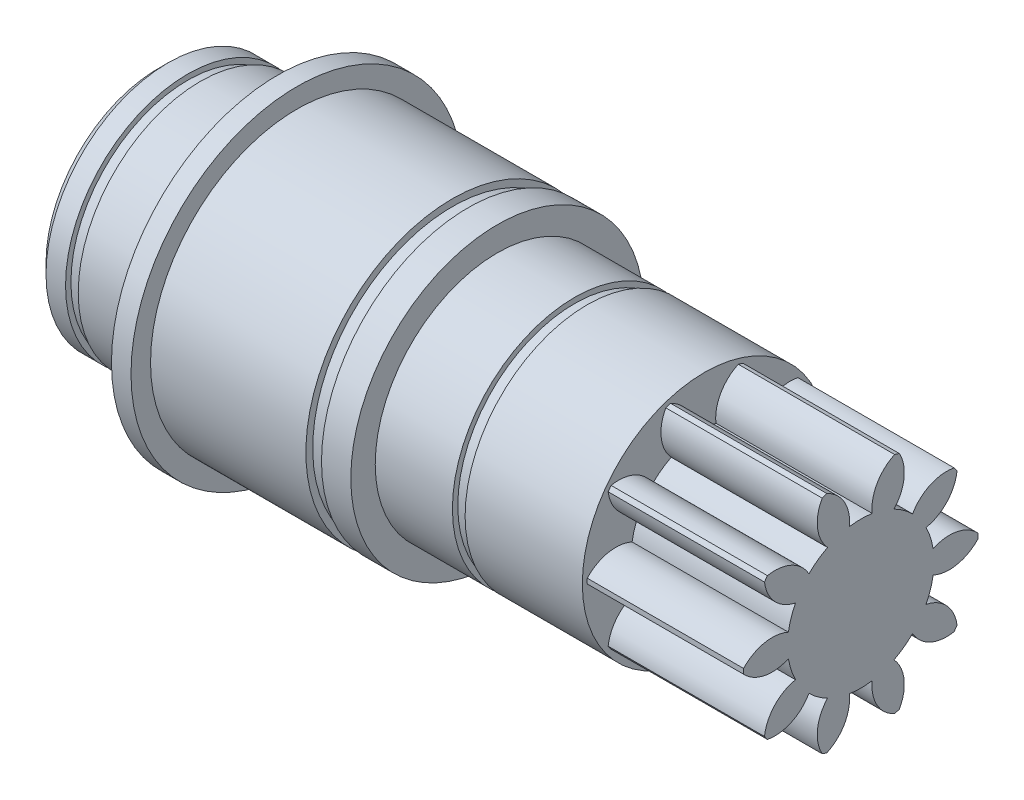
SolidWorks part; units mm, degrees
ref_plane "Plane1" through (0, 0, 0) normal (0, 0, 1) x (1, 0, 0)
ref_plane "Plane2" through (0, 0, 0) normal (0, 1, 0) x (1, 0, 0)
ref_plane "Plane3" through (0, 0, 0) normal (1, 0, 0) x (0, 0, -1)
sketch "HoldingSke" plane through (0, 0, 0) normal (0, 1, 0) x (1, 0, 0)
  line L0 (0, 0) -> (0.4924, -0.0868)
  line L1 (-15, 0) -> (100, 0) construction
  line L2 (0, 0) -> (-2.1039, 2.3779)
  line L3 (0, 0) -> (-11.863, 4.5341)
  line L4 (0, 0) -> (8.5048, 1.4996)
  line L5 (0, 0) -> (-46.8476, -17.4728)
  line L6 (0, 0) -> (-13.2634, -8.9489)
  line L7 (-2.1039, 2.3779) -> (8.6586, 51.2059)
  line L8 (-76.2, 54.61) -> (-73.9, 54.61)
  line L9 (-71.009, 38.7566) -> (-53.1078, 45.2721)
  line L10 (-76.2, 71.12) -> (104.1128, 71.12)
  line L11 (0, 0) -> (-16, 0)
  line L12 (-76.2, 101.6) -> (-76.133, 101.6)
  line L13 (24.9733, 27.94) -> (52.9518, 28.4284)
  line L14 (24.9733, 27.94) -> (24.9743, 27.94)
  line L15 (24.9733, 27.94) -> (100.4006, 29.5858)
  line L16 (-63.627, -2) -> (-12.827, -2)
  circle A0 centre (0, 0) radius 8
  circle A1 centre (0, 0) radius 7.499
  circle A2 centre (0, 0) radius 37.5
  circle A3 centre (0, 0) radius 7.4736
  dimension "MHD" = 14.998
  dimension "Hub_dia" = 75
  dimension "Bore" = 16
  dimension "MBD" = 14.9472
  dimension "Num_teeth" = 10
  dimension "Pitch_radius" = 180.3128
  dimension "Pitch" = 0.5
  dimension "Width" = 16
  dimension "Overall_len" = 50
  dimension "Show_teeth" = 10
  dimension "Thickness" = 16
  dimension "OAL" = 50.0001
  dimension "T_dim" = 2.3
  dimension "Ap" = 20
  dimension "H" = 19.05
  dimension "Backlash" = 0.067
  dimension "Addendum_fac" = 1
  dimension "Dedendum_fac" = 1.25
  dimension "Clearance_fac" = 0.25
  dimension "Dedendum_add" = 0.001
  dimension "Module" = 2
sketch "BasProSke" plane through (0, 0, 0) normal (0, 1, 0) x (1, 0, 0)
  line L0 (-10, 0) -> (60, 0) construction
  line L1 (0, 0) -> (0, 12)
  line L2 (0, 0) -> (16, 0)
  line L3 (16, 0) -> (16, 12)
  line L4 (16, 12) -> (0, 12)
  dimension "Diameter" = 24
  dimension "Thickness" = 16
revolve "Base-Revolve" add sketch "BasProSke" angle 360 about L0
sketch "TooCutSke" plane through (0, 0, 0) normal (1, 0, 0) x (0, 0, -1)
  line L1 (0, 0) -> (0, 107) construction
  line L2 (0, 0) -> (-1.6814, 9.8576) construction
  line L3 (0, 0) -> (-6.1153, 18.8209) construction
  line L4 (-1.6814, 9.8576) -> (-3.0576, 9.4105) construction
  arc A0 (1.1737, 7.4066) -> (-1.1737, 7.4066) centre (0, 0) ccw
  arc A1 (3.4979, 11.5054) -> (-3.4979, 11.5054) centre (0, 0) ccw
  circle A2 centre (0, 0) radius 10 construction
  circle A3 centre (0, 0) radius 9.3969 construction
  arc A4 (-1.1737, 7.4066) -> (-3.4979, 11.5054) centre (-5.1477, 7.8615) ccw
  arc A5 (3.4979, 11.5054) -> (1.1737, 7.4066) centre (5.1477, 7.8615) ccw
  dimension "Root_dia" = 14.998
  dimension "Overcut_dia" = 24.0508
  dimension "Pitch_dia" = 20
  dimension "Base_dia" = 18.7939
  dimension "Flank_rad" = 4
  dimension "Half_ang" = 18
  dimension "Half_CT" = 1.4471
extrude "ToothCut" cut sketch "TooCutSke" along normal through all
fillet "Breaks" radius 0.04
fillet "RootFillets" radius 0.501
pattern_circular "TeethCuts" count 10 every 36 about axis through (-10, 0, 0) along (1, 0, 0) of "ToothCut", "RootFillets", "Breaks"
sketch "HubNeaOneSke" plane through (0, 0, 0) normal (-1, 0, 0) x (0, 0, 1)
  circle A0 centre (0, 0) radius 7.499
  dimension "Diameter" = 14.998
extrude "HubNearOne" add sketch "HubNeaOneSke" along normal blind 34.0001
sketch "HubNeaBotSke" plane through (0, 0, 0) normal (-1, 0, 0) x (0, 0, 1)
  circle A0 centre (0, 0) radius 7.499
  dimension "Diameter" = 14.998
extrude "HubNearBoth" add sketch "HubNeaBotSke" along normal blind 17
ref_plane "FarPln" through (16, 0, 0) normal (1, 0, 0) x (0, 0, -1)
sketch "HubFarSke" plane through (16, 0, 0) normal (1, 0, 0) x (0, 0, -1)
  circle A0 centre (0, 0) radius 7.499
  dimension "Diameter" = 14.998
extrude "HubFar" add sketch "HubFarSke" along normal blind 17
sketch "BorSke" plane through (0, 0, 0) normal (1, 0, 0) x (0, 0, -1)
  circle A0 centre (0, 0) radius 7.4736
  dimension "Diameter" = 14.9472
extrude "Bore" cut sketch "BorSke" along normal mid plane 100.0001
sketch "KeySke" plane through (0, 0, 0) normal (1, 0, 0) x (0, 0, -1)
  line L0 (-2.5, 0) -> (-2.5, 9.7736)
  line L1 (-2.5, 9.7736) -> (2.5, 9.7736)
  line L2 (2.5, 9.7736) -> (2.5, 0)
  line L3 (0, 0) -> (0, 34) construction
  line L4 (-2.5, 0) -> (2.5, 0)
  dimension "Offset" = 9.7736
  dimension "Width" = 5
extrude "Keyway" cut sketch "KeySke" along normal mid plane 100.0001
pattern_circular "Keyway2" count 2 every 90 about axis through (-10, 0, 0) along (1, 0, 0)
sketch "Esquisse1" plane through (16, 0, 0) normal (1, 0, 0) x (0, 0, -1)
  circle A0 centre (0, 0) radius 7.499
  arc A1 (3.404, -6.6819) -> (5.303, -5.3022) centre (0, 0) ccw construction
extrude "Extrusion2" add sketch "Esquisse1" against normal blind 16
sketch "Esquisse2" plane through (0, 0, 0) normal (-1, 0, 0) x (0, 0, 1)
  circle A0 centre (0, 0) radius 12.5
  dimension "D1" = 25
extrude "Extrusion3" add sketch "Esquisse2" along normal blind 12
sketch "Esquisse3" plane through (-12, 0, 0) normal (-1, 0, 0) x (0, 0, 1)
  circle A0 centre (0, 0) radius 11.95
  dimension "D1" = 23.9
extrude "Extrusion4" add sketch "Esquisse3" along normal blind 1.3
sketch "Esquisse4" plane through (-13.3, 0, 0) normal (-1, 0, 0) x (0, 0, 1)
  circle A0 centre (0, 0) radius 12.5
  dimension "D1" = 25
extrude "Extrusion5" add sketch "Esquisse4" along normal blind 7.9
sketch "Esquisse5" plane through (-21.2, 0, 0) normal (-1, 0, 0) x (0, 0, 1)
  circle A0 centre (0, 0) radius 15
  dimension "D1" = 30
extrude "Extrusion6" add sketch "Esquisse5" along normal blind 3
sketch "Esquisse6" plane through (-24.2, 0, 0) normal (-1, 0, 0) x (0, 0, 1)
  circle A0 centre (0, 0) radius 14.3
  dimension "D1" = 28.6
extrude "Extrusion7" add sketch "Esquisse6" along normal blind 1.6
sketch "Esquisse7" plane through (-25.8, 0, 0) normal (-1, 0, 0) x (0, 0, 1)
  circle A0 centre (0, 0) radius 15
  dimension "D1" = 30
extrude "Extrusion8" add sketch "Esquisse7" along normal blind 15.9
sketch "Esquisse8" plane through (-41.7, 0, 0) normal (-1, 0, 0) x (0, 0, 1)
  circle A0 centre (0, 0) radius 17
  dimension "D1" = 34
extrude "Extrusion9" add sketch "Esquisse8" along normal blind 2
sketch "Esquisse9" plane through (-43.7, 0, 0) normal (-1, 0, 0) x (0, 0, 1)
  circle A0 centre (0, 0) radius 12.5
  dimension "D1" = 25
extrude "Extrusion11" add sketch "Esquisse9" along normal blind 7.9
sketch "Esquisse10" plane through (-51.6, 0, 0) normal (-1, 0, 0) x (0, 0, 1)
  circle A0 centre (0, 0) radius 11.95
  dimension "D1" = 23.9
extrude "Extrusion12" add sketch "Esquisse10" along normal blind 1.3
sketch "Esquisse11" plane through (-52.9, 0, 0) normal (-1, 0, 0) x (0, 0, 1)
  circle A0 centre (0, 0) radius 12.5
  dimension "D1" = 25
extrude "Extrusion13" add sketch "Esquisse11" along normal blind 3
chamfer "Chanfrein1" distance 1 angle 45 1 edges at (-55.9, 0, 12.5)
sketch "Esquisse12" plane through (-25.8, 0, 0) normal (1, 0, 0) x (0, 0, -1)
  line L0 (-1.3083, -18.3504) -> (-8.9735, -16.06)
  line L1 (-8.9735, -16.06) -> (-6.9694, -9.353)
  line L2 (-6.9694, -9.353) -> (0.6957, -11.6434)
  line L3 (0.6957, -11.6434) -> (-1.3083, -18.3504)
  dimension "D1" = 7
extrude "Enlèv. mat.-Extru.1" cut sketch "Esquisse12" against normal blind 15
equation "' \"Module@HoldingSke\" = 6.35"
equation "' \"Num_teeth@HoldingSke\" = 12"
equation "' \"Ap@HoldingSke\" =  20"
equation "' \"Width@HoldingSke\" = 0.5 * 25.4"
equation "' \"Hub_dia@HoldingSke\"= 1 * 25.4"
equation "' \"Overall_len@HoldingSke\" = 1.0 * 25.4"
equation "' \"Bore@HoldingSke\" = 0.75 * 25.4"
equation "' \"T_dim@HoldingSke\" = 0.1 * 25.4"
equation "' \"Width@KeySke\" = 0.25 * 25.4"
equation "' \"Show_teeth@HoldingSke\" = 13"
equation "' \"Backlash@HoldingSke\" = 0.009 * 25.4"
equation "' \"Addendum_fac@HoldingSke\" = 1.0"
equation "' \"Dedendum_fac@HoldingSke\" = 1.25"
equation "' \"Dedendum_add@HoldingSke\" = 0.00005 * 25.4"
equation "' \"Clearance_fac@HoldingSke\" = 0.25"
equation "\"Pitch@HoldingSke\" = 1 / \"Module@HoldingSke\""
equation "\"Overcut_dia@TooCutSke\" = (\"Num_teeth@HoldingSke\" + 2 * \"Addendum_fac@HoldingSke\") / \"Pitch@HoldingSke\" + 0.002 * 25.4"
equation "\"Pitch_dia@TooCutSke\" = \"Num_teeth@HoldingSke\" / \"Pitch@HoldingSke\""
equation "\"Base_dia@TooCutSke\" = \"Num_teeth@HoldingSke\" / \"Pitch@HoldingSke\" * cos((\"Ap@HoldingSke\"  * 3.14159265 / 180))"
equation "\"Root_dia@TooCutSke\" = (\"Num_teeth@HoldingSke\" + 2) / \"Pitch@HoldingSke\" - 2 * (\"Addendum_fac@HoldingSke\" + \"Dedendum_fac@HoldingSke\") / \"Pitch@HoldingSke\" - \"Dedendum_add@HoldingSke\" * 2"
equation "\"Half_ang@TooCutSke\" = 180 / \"Num_teeth@HoldingSke\""
equation "\"Half_CT@TooCutSke\" = \"Num_teeth@HoldingSke\" / \"Pitch@HoldingSke\" * sin((3.14159265 / 2 / \"Num_teeth@HoldingSke\")) / 2 - 7 * \"Backlash@HoldingSke\" / 4"
equation "\"Flank_rad@TooCutSke\" = \"Num_teeth@HoldingSke\" / \"Pitch@HoldingSke\" / 5"
equation "\"Radius@RootFillets\" = \"Clearance_fac@HoldingSke\" / \"Pitch@HoldingSke\" + \"Dedendum_add@HoldingSke\""
equation "\"Break_rad@Breaks\" = 0.02 / \"Pitch@HoldingSke\""
equation "\"Thickness@HoldingSke\" = \"Width@HoldingSke\""
equation "\"OAL@HoldingSke\" = \"Thickness@HoldingSke\""
equation "\"MHD@HoldingSke\" = (\"Num_teeth@HoldingSke\" + 2) / \"Pitch@HoldingSke\" - 2 * (\"Addendum_fac@HoldingSke\" + \"Dedendum_fac@HoldingSke\")  / \"Pitch@HoldingSke\" - \"Dedendum_add@HoldingSke\" * 2"
equation "\"MBD@HoldingSke\" = (\"Num_teeth@HoldingSke\" + 2) / \"Pitch@HoldingSke\" - 2 * (\"Addendum_fac@HoldingSke\" + \"Dedendum_fac@HoldingSke\")  / \"Pitch@HoldingSke\" - \"Dedendum_add@HoldingSke\" * 2 - 0.002 * 25.4"
equation "\"MHD@HoldingSke\" = ((sgn( \"MHD@HoldingSke\" - \"Hub_dia@HoldingSke\" )-1)*( \"MHD@HoldingSke\" - \"Hub_dia@HoldingSke\" ))/-2+ \"Hub_dia@HoldingSke\""
equation "\"MBD@HoldingSke\" = ((sgn( \"MBD@HoldingSke\" - \"Bore@HoldingSke\" )-1)*( \"MBD@HoldingSke\" - \"Bore@HoldingSke\" ))/-2+ \"Bore@HoldingSke\""
equation "\"OAL@HoldingSke\" = ((sgn( \"OAL@HoldingSke\" - \"Overall_len@HoldingSke\" )+1)*( \"OAL@HoldingSke\" - \"Overall_len@HoldingSke\" ))/2 + \"Overall_len@HoldingSke\" + 0.000002 * 25.4"
equation "\"Num_teeth@TeethCuts\" = int( \"Show_teeth@HoldingSke\" ) + 1"
equation "\"Num_teeth@TeethCuts\" = ((sgn( \"Num_teeth@TeethCuts\" - \"Num_teeth@HoldingSke\" )-1)*( \"Num_teeth@TeethCuts\" - \"Num_teeth@HoldingSke\" ))/-2+ \"Num_teeth@HoldingSke\""
equation "\"Num_teeth@TeethCuts\" = ((sgn( \"Num_teeth@TeethCuts\" - 2.0)+1)*( \"Num_teeth@TeethCuts\" - 2.0))/2 +2.0"
equation "\"Angle@TeethCuts\" = 360.0 / \"Num_teeth@HoldingSke\""
equation "\"Diameter@BasProSke\" = (\"Num_teeth@HoldingSke\" + 2 * \"Addendum_fac@HoldingSke\") / \"Pitch@HoldingSke\""
equation "\"Thickness@BasProSke\"  = \"Thickness@HoldingSke\""
equation "' \"Fillet_rad@BasProSke\" =  \"Thickness@HoldingSke\" * 0.05"
equation "\"MHD@HoldingSke\" = ((sgn( \"MHD@HoldingSke\" - \"Root_dia@TooCutSke\" )-1)*( \"MHD@HoldingSke\" - \"Root_dia@TooCutSke\" ))/-2+ \"Root_dia@TooCutSke\""
equation "\"Diameter@HubNeaOneSke\" = \"MHD@HoldingSke\""
equation "\"Length@HubNearOne\" = \"OAL@HoldingSke\" - \"Thickness@BasProSke\""
equation "\"Diameter@HubNeaBotSke\" = \"MHD@HoldingSke\""
equation "\"Length@HubNearBoth\" = ( \"OAL@HoldingSke\" - \"Thickness@BasProSke\" ) / 2.0"
equation "\"Thickness@FarPln\" = \"Thickness@BasProSke\""
equation "\"Diameter@HubFarSke\" = \"MHD@HoldingSke\""
equation "\"Length@HubFar\" = ( \"OAL@HoldingSke\" - \"Thickness@BasProSke\" ) / 2.0"
equation "\"Diameter@BorSke\" = \"MBD@HoldingSke\""
equation "\"D1@Bore\" = \"OAL@HoldingSke\" * 2.0"
equation "\"D1@Keyway\" = \"OAL@HoldingSke\" * 2.0"
equation "\"Offset@KeySke\" = \"T_dim@HoldingSke\" + \"MBD@HoldingSke\" / 2.0"
